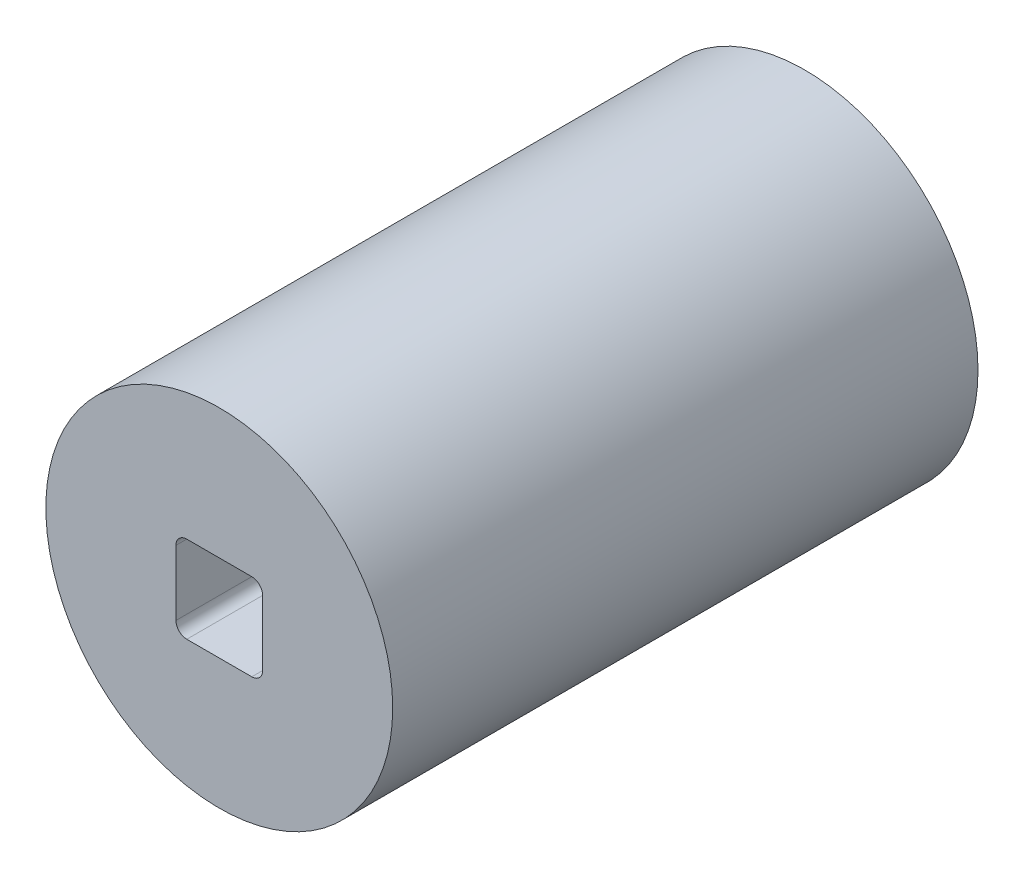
SolidWorks part; units mm, degrees
ref_plane "Front Plane" through (0, 0, 0) normal (1, 0, 0) x (0, 1, 0)
ref_plane "Top Plane" through (0, 0, 0) normal (0, 0, 1) x (0, 1, 0)
ref_plane "Right Plane" through (0, 0, 0) normal (0, 1, 0) x (-1, 0, 0)
sketch "Sketch1" plane through (0, 0, 0) normal (0, 0, 1) x (0, 1, 0)
  circle A0 centre (0, 0) radius 406.4
  dimension "D1" = 812.8
extrude "Boss-Extrude1" add sketch "Sketch1" against normal blind 1371.6
sketch "6in Beam Hex"
sketch_block_instance "Blk 6in Hex-1"
sketch_block "Blk 6in Hex" parameters "D1"=152.4, "D2"=152.4
sketch "Sketch3" plane through (0, 0, 0) normal (0, 0, 1) x (0, 1, 0)
  line B0 (-76.2, -88.9) -> (76.2, -88.9)
  line B1 (-88.9, -76.2) -> (-88.9, 76.2)
  line B2 (76.2, 88.9) -> (-76.2, 88.9)
  line B3 (88.9, 76.2) -> (88.9, -76.2)
  line B4 (-76.2, -101.6) -> (76.2, -101.6)
  line B5 (-101.6, -76.2) -> (-101.6, 76.2)
  line B6 (76.2, 101.6) -> (-76.2, 101.6)
  line B7 (101.6, 76.2) -> (101.6, -76.2)
  arc B8 (101.6, 76.2) -> (76.2, 101.6) centre (76.2, 76.2) ccw
  arc B9 (76.2, -101.6) -> (101.6, -76.2) centre (76.2, -76.2) ccw
  arc B10 (-101.6, -76.2) -> (-76.2, -101.6) centre (-76.2, -76.2) ccw
  arc B11 (-76.2, 101.6) -> (-101.6, 76.2) centre (-76.2, 76.2) ccw
  arc B12 (-76.2, 88.9) -> (-88.9, 76.2) centre (-76.2, 76.2) ccw
  arc B13 (88.9, 76.2) -> (76.2, 88.9) centre (76.2, 76.2) ccw
  arc B14 (76.2, -88.9) -> (88.9, -76.2) centre (76.2, -76.2) ccw
  arc B15 (-88.9, -76.2) -> (-76.2, -88.9) centre (-76.2, -76.2) ccw
  line B16 (-76.2, 76.2) -> (76.2, -76.2) construction
sketch_block_instance "8x8x0.5-1"
sketch_block "8x8x0.5" parameters "D1"=25.4, "D2"=12.7, "D3"=12.7, "D4"=12.7, "D5"=203.2, "D6"=203.2, "D7"=177.8, "D8"=177.8
extrude "Cut-Extrude1" cut sketch "Sketch3" against normal blind 1330.325 contours B1 B15 B0 B14 B3 B13 B2 B12 | B6 B11 B5 B10 B4 B9 B7 B8 B15 B1 B12 B2 B13 B3 B14 B0
ref_plane "Plane1" through (0, 0, -1330.325) normal (0, 0, 1) x (0, 1, 0)
sketch "Sketch4" plane through (0, 0, -1330.325) normal (0, 0, 1) x (0, -1, 0)
  line B0 (131.9823, -228.6) -> (263.9645, 0)
  line B1 (263.9645, 0) -> (131.9823, 228.6)
  line B2 (131.9823, 228.6) -> (-131.9823, 228.6)
  line B3 (-131.9823, 228.6) -> (-263.9645, 0)
  line B4 (-263.9645, 0) -> (-131.9823, -228.6)
  line B5 (-131.9823, -228.6) -> (131.9823, -228.6)
  circle B6 centre (0, 0) radius 228.6 construction
sketch_block_instance "Hex Plate 6in-1"
sketch_block "Hex Plate 6in"
extrude "Cut-Extrude2" cut sketch "Sketch4" along normal blind 19.05
